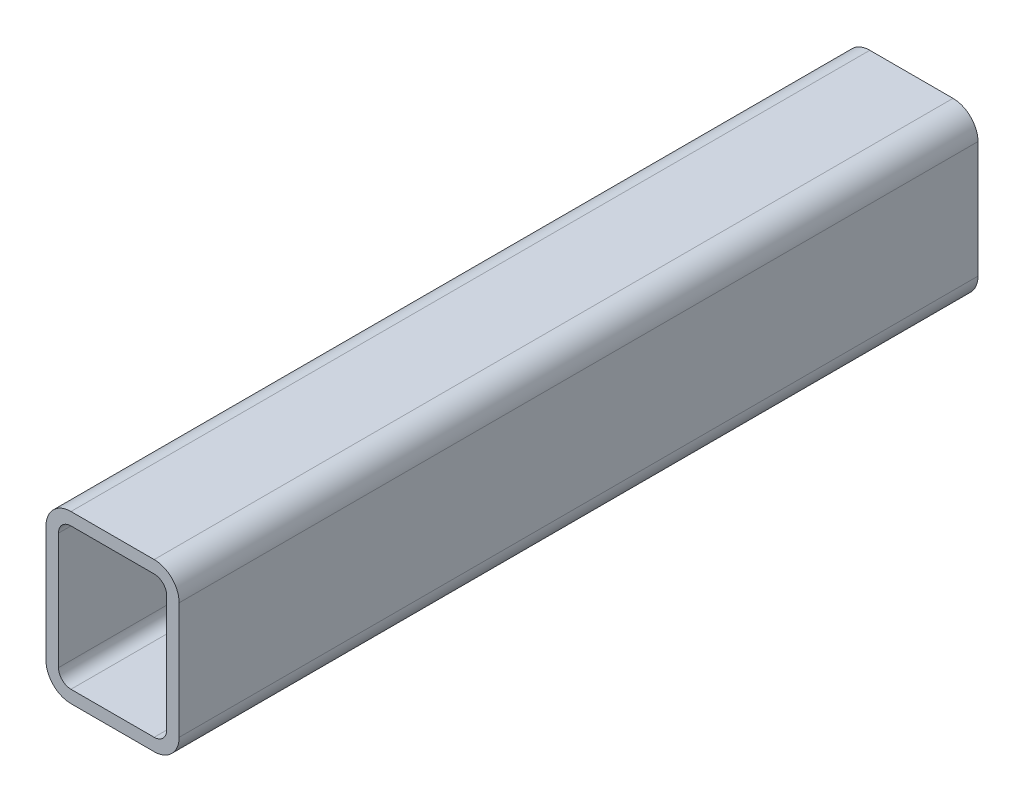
SolidWorks part; units mm, degrees
ref_plane "Front Plane" through (0, 0, 0) normal (0, 0, 1) x (1, 0, 0)
ref_plane "Top Plane" through (0, 0, 0) normal (0, 1, 0) x (1, 0, 0)
ref_plane "Right Plane" through (0, 0, 0) normal (1, 0, 0) x (0, 0, -1)
sketch "Sketch1" plane through (0, 0, 0) normal (0, 0, 1) x (1, 0, 0)
  line B0 (50.8, 53.975) -> (50.8, 9.525)
  line B1 (9.525, 63.5) -> (41.275, 63.5)
  arc B2 (50.8, 53.975) -> (41.275, 63.5) centre (41.275, 53.975) ccw
  arc B3 (41.275, 0) -> (50.8, 9.525) centre (41.275, 9.525) ccw
  line B4 (41.275, 0) -> (9.525, 0)
  arc B5 (0, 9.525) -> (9.525, 0) centre (9.525, 9.525) ccw
  line B6 (0, 9.525) -> (0, 53.975)
  arc B7 (9.525, 63.5) -> (0, 53.975) centre (9.525, 53.975) ccw
  line B8 (9.525, 58.7375) -> (41.275, 58.7375)
  arc B9 (46.0375, 53.975) -> (41.275, 58.7375) centre (41.275, 53.975) ccw
  line B10 (46.0375, 53.975) -> (46.0375, 9.525)
  arc B11 (41.275, 4.7625) -> (46.0375, 9.525) centre (41.275, 9.525) ccw
  line B12 (41.275, 4.7625) -> (9.525, 4.7625)
  arc B13 (4.7625, 9.525) -> (9.525, 4.7625) centre (9.525, 9.525) ccw
  line B14 (4.7625, 9.525) -> (4.7625, 53.975)
  arc B15 (9.525, 58.7375) -> (4.7625, 53.975) centre (9.525, 53.975) ccw
sketch_block_instance "HSS2.5x2x0.1875-1"
sketch_block "HSS2.5x2x0.1875"
extrude "Boss-Extrude1" add sketch "Sketch1" along normal blind 304.8
